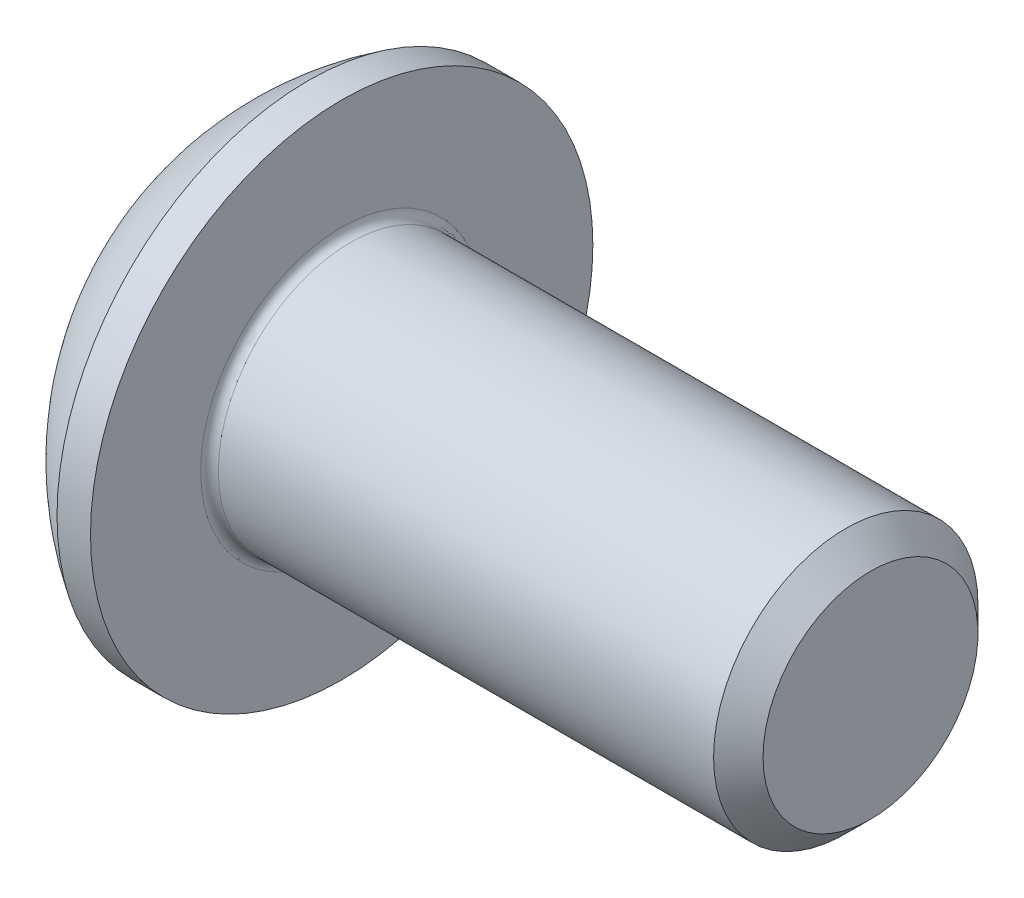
SolidWorks part; units mm, degrees
ref_plane "Plane1" through (0, 0, 0) normal (0, 0, 1) x (1, 0, 0)
ref_plane "Plane2" through (0, 0, 0) normal (0, 1, 0) x (1, 0, 0)
ref_plane "Plane3" through (0, 0, 0) normal (1, 0, 0) x (0, 0, -1)
sketch "BodySke" plane through (0, 0, 0) normal (0, 0, 1) x (1, 0, 0)
  line L0 (7.65, 0) -> (7.65, 1.2195)
  line L1 (7.3695, 1.5) -> (1.65, 1.5)
  line L2 (1.65, 1.5) -> (1.65, 2.85)
  line L3 (1.65, 2.85) -> (1.27, 2.85)
  line L4 (0, 0) -> (101.6, 0) construction
  line L5 (1.65, -2.85) -> (1.27, -2.85) construction
  line L6 (55.6768, -1.5) -> (1.65, -1.5) construction
  line L7 (7.65, 0) -> (0, 0)
  line L8 (0, 1.425) -> (0, -1.425) construction
  line L9 (0, 0) -> (0, 1.425)
  line L10 (7.65, 1.2195) -> (7.3695, 1.5)
  line L11 (7.65, -1.2195) -> (7.3695, -1.5) construction
  line L12 (2.15, 9.525) -> (2.15, -1.5) construction
  line L13 (1.65, 9.525) -> (1.65, -1.5) construction
  arc A1 (0, 1.425) -> (1.27, 2.85) centre (3.0334, 0) cw
  dimension "D1" = 2.85
  dimension "Diameter" = 3
  dimension "Length" = 6
  dimension "Head_dia" = 5.7
  dimension "Head_ht" = 1.65
  dimension "Head_side_ht" = 0.38
  dimension "Minor_dia" = 2.439
  dimension "Body_ch_ang" = 45
  dimension "Advance" = 0.5
  dimension "Thread_nom" = 6
revolve "BaseBody" add sketch "BodySke" angle 360 about L4
fillet "Fillet1" radius 0.1 1 edges at (1.65, 0, 1.5)
sketch "Sketch2" plane through (0, 0, 0) normal (0, 0, 1) x (1, 0, 0)
  line L0 (0, 1) -> (1.04, 1)
  line L1 (1.04, 1) -> (1.6174, 0)
  line L3 (1.6174, 0) -> (0, 0)
  line L4 (0, 0) -> (0, 1)
  line L5 (0, -1) -> (1.04, -1) construction
  line L6 (0, 0) -> (47.625, 0) construction
  dimension "D2" = 60
  dimension "PreBroach_depth" = 1.04
  dimension "PreBroach_dia" = 2
revolve "PreBroach" cut sketch "Sketch2" angle 360 about L6
sketch "Sketch3" plane through (0, 0, 0) normal (1, 0, 0) x (0, 0, -1)
  line L0 (-1, -0.5774) -> (-1, 0.5774)
  line L1 (-1, 0.5774) -> (0, 1.1547)
  line L2 (0, 1.1547) -> (1, 0.5774)
  line L3 (1, 0.5774) -> (1, -0.5774)
  line L4 (1, -0.5774) -> (0, -1.1547)
  line L5 (0, -1.1547) -> (-1, -0.5774)
  dimension "D1" = 1
  dimension "D2" = 1
  dimension "D3" = 2
  dimension "Hex_size" = 2
extrude "Hex" cut sketch "Sketch3" along normal blind 1.04
sketch "ThdSchSke" plane through (0, 0, 0) normal (0, 0, 1) x (1, 0, 0)
  line L0 (2.65, -1.2195) -> (2.4536, -1.5)
  line L1 (2.65, -1.2195) -> (2.8464, -1.5)
  line L2 (2.8464, -1.5) -> (2.8464, -1.875)
  line L3 (-3.175, 0) -> (5.1513, 0) construction
  line L5 (2.8464, -1.875) -> (2.4536, -1.875)
  line L6 (2.4536, -1.875) -> (2.4536, -1.5)
  dimension "Thread_minor" = 2.439
  dimension "Diameter" = 3
  dimension "Start" = 2.65
  dimension "SideAngle" = 55
  dimension "VeeAngle" = 70
  dimension "Overcut" = 3.75
revolve "ThreadSchematic" [suppressed] cut sketch "ThdSchSke" angle 360 about L3
pattern_linear "ThdSchPat" [suppressed]
equation "\"D1@BodySke\" = \"Head_dia@BodySke\" * .5"
equation "\"Thread_minor@ThreadCosmetic\" = \"Minor_dia@BodySke\""
equation "\"D1@Sketch3\" = \"Hex_size@Sketch3\" / 2"
equation "\"D2@Sketch3\" = \"D1@Sketch3\""
equation "\"D3@Sketch3\" = \"Hex_size@Sketch3\""
equation "\"Thread_length@ThreadCosmetic\" = ((sgn( (\"Length@BodySke\" - \"Advance@BodySke\" * 2.0) - \"Thread_nom@BodySke\" )-1)*( (\"Length@BodySke\" - \"Advance@BodySke\" * 2.0) - \"Thread_nom@BodySke\" ))/-2+ \"Thread_no"
equation "\"Thread_minor@ThdSchSke\" = \"Minor_dia@BodySke\""
equation "\"Diameter@ThdSchSke\" = \"Diameter@BodySke\""
equation "\"Overcut@ThdSchSke\" = \"Diameter@BodySke\" * 1.25"
equation "\"Start@ThdSchSke\" = \"Head_ht@BodySke\" + \"Length@BodySke\" - \"Thread_length@ThreadCosmetic\"  '---Non-countersunk---"
equation "\"Num_threads@ThdSchPat\" = int( \"Thread_length@ThreadCosmetic\" / \"Advance@BodySke\" + 0.999 )  + 1"
equation "\"Advance@ThdSchPat\" = \"Thread_length@ThreadCosmetic\" /  (\"Num_threads@ThdSchPat\" - 1) 'relax it"
equation "\"Num_threads@ThdSchPat\" = \"Num_threads@ThdSchPat\" - sgn( \"Num_threads@ThdSchPat\" - 1) '---chamfered tips only---"
